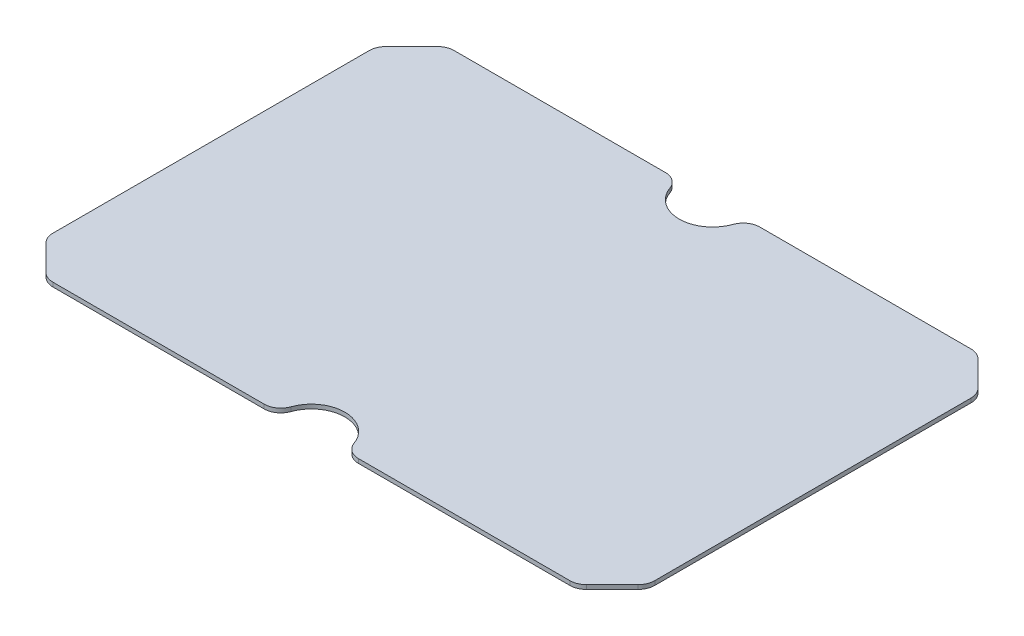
SolidWorks part; units mm, degrees
ref_plane "Front Plane" through (0, 0, 0) normal (0, 0, 1) x (1, 0, 0)
ref_plane "Top Plane" through (0, 0, 0) normal (0, 1, 0) x (1, 0, 0)
ref_plane "Right Plane" through (0, 0, 0) normal (1, 0, 0) x (0, 0, -1)
sketch "Sketch1" plane through (0, 0, 0) normal (0, 1, 0) x (1, 0, 0)
  line L1 (-457.2, -304.8) -> (457.2, -304.8)
  line L2 (-457.2, -304.8) -> (-457.2, 304.8)
  line L3 (-457.2, 304.8) -> (457.2, 304.8)
  line L4 (457.2, -304.8) -> (457.2, 304.8)
  line L5 (-457.2, -304.8) -> (457.2, 304.8) construction
  line L6 (-457.2, 304.8) -> (457.2, -304.8) construction
  point P0 (0, 0)
  dimension "D1" = 914.4
  dimension "D2" = 609.6
extrude "Boss-Extrude1" add sketch "Sketch1" along normal blind 6.35
sketch "Sketch2" plane through (0, 6.35, 0) normal (0, 1, 0) x (1, 0, 0)
  line L0 (-457.2, -304.8) -> (457.2, -304.8) construction
  circle A0 centre (0, -304.8) radius 50.8
  dimension "D1" = 101.6
extrude "Cut-Extrude1" cut sketch "Sketch2" against normal through all
mirror "Mirror1" about plane through (0, 0, 0) normal (0, 0, 1) of "Cut-Extrude1"
chamfer "Chamfer1" distance 53.975 angle 45 4 edges at (457.2, 3.175, 304.8) (457.2, 3.175, -304.8) (-457.2, 3.175, -304.8) (-457.2, 3.175, 304.8)
fillet "Fillet1" radius 25.4 12 edges at (50.8, 3.175, 304.8) (-50.8, 3.175, 304.8) (403.225, 3.175, -304.8) (457.2, 3.175, -250.825) (457.2, 3.175, 250.825) (403.225, 3.175, 304.8) (-403.225, 3.175, 304.8) (-457.2, 3.175, 250.825) (-403.225, 3.175, -304.8) (-457.2, 3.175, -250.825) (50.8, 3.175, -304.8) (-50.8, 3.175, -304.8)
equation "\"D2@Sketch1\" = \"D3@Desk Control Sketch@CF Desk Tube Frame-1.Part\""
equation "\"D1@Sketch1\" = \"D2@Desk Control Sketch@CF Desk Tube Frame-1.Part\"- ( \"D6@Desk Control Sketch@CF Desk Tube Frame-1.Part\"*2 ) "
